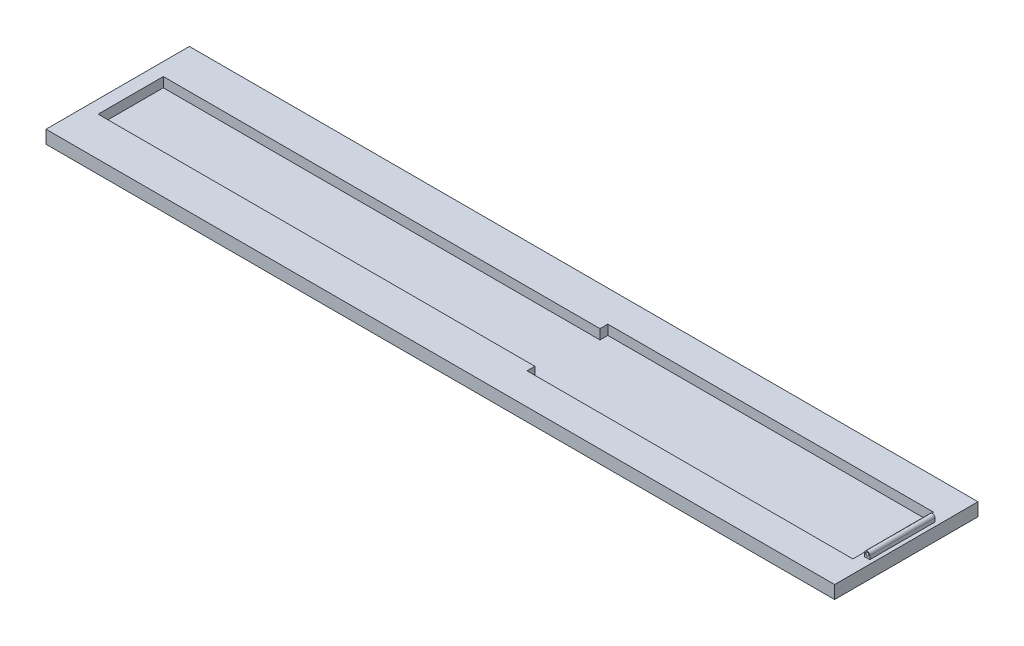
SolidWorks part; units mm, degrees
ref_plane "Face" through (0, 0, 0) normal (0, 0, 1) x (1, 0, 0)
ref_plane "Dessus" through (0, 0, 0) normal (0, 1, 0) x (1, 0, 0)
ref_plane "Droite" through (0, 0, 0) normal (1, 0, 0) x (0, 0, -1)
sketch "Esquisse1" plane through (0, 0, 0) normal (0, 0, 1) x (1, 0, 0)
  line L1 (-12000, -55) -> (100, -55)
  line L2 (-12000, -55) -> (-12000, -255)
  line L3 (-12000, -255) -> (100, -255)
  line L4 (100, -55) -> (100, -255)
  dimension "D1" = 12100
  dimension "D2" = 100
  dimension "D3" = 55
  dimension "D4" = 200
extrude "Extrusion1" add sketch "Esquisse1" along normal mid plane 2200
sketch "Esquisse2" plane through (0, 0, 0) normal (0, 0, 1) x (1, 0, 0)
  line L0 (-40, 0) -> (-40, -55)
  line L1 (100, -55) -> (-12000, -55) construction
  line L2 (-40, -55) -> (40, -55)
  line L3 (40, -55) -> (40, 0)
  circle A0 centre (0, 0) radius 25
  arc A1 (40, 0) -> (-40, 0) centre (0, 0) ccw
  dimension "D1" = 50
  dimension "D2" = 80
extrude "Extrusion2" add sketch "Esquisse2" along normal mid plane 1000
sketch "Esquisse3" plane through (0, -55, 0) normal (0, 1, 0) x (1, 0, 0)
  line L0 (100, -1100) -> (100, 1100) construction
  line L1 (-5100, 620) -> (-100, 620)
  line L2 (-5100, 620) -> (-5100, 500)
  line L3 (-5100, -620) -> (-100, -620)
  line L4 (-100, 620) -> (-100, -620)
  line L5 (100, 1100) -> (-12000, 1100) construction
  line L6 (100, -1100) -> (-12000, -1100) construction
  line L8 (-12000, -1100) -> (-12000, 1100) construction
  line L9 (-5100, 500) -> (-11800, 500)
  line L11 (-5100, -500) -> (-11800, -500)
  line L12 (-11800, 500) -> (-11800, -500)
  line L13 (-5100, -500) -> (-5100, -620)
  dimension "D1" = 200
  dimension "D2" = 480
  dimension "D3" = 480
  dimension "D4" = 5000
  dimension "D5" = 200
  dimension "D6" = 600
  dimension "D7" = 600
extrude "Enlèv. mat.-Extru.1" cut sketch "Esquisse3" against normal blind 150
sketch "Esquisse4" plane through (0, -255, 0) normal (0, -1, 0) x (1, 0, 0)
  line L0 (-12000, 1100) -> (100, 1100) construction
  line L1 (-12000, 1100) -> (-12000, -1100) construction
  point P0 (-5975, 0)
  point P3 (-12000, 0)
  dimension "D1" = 1100
  dimension "D2" = 5975
